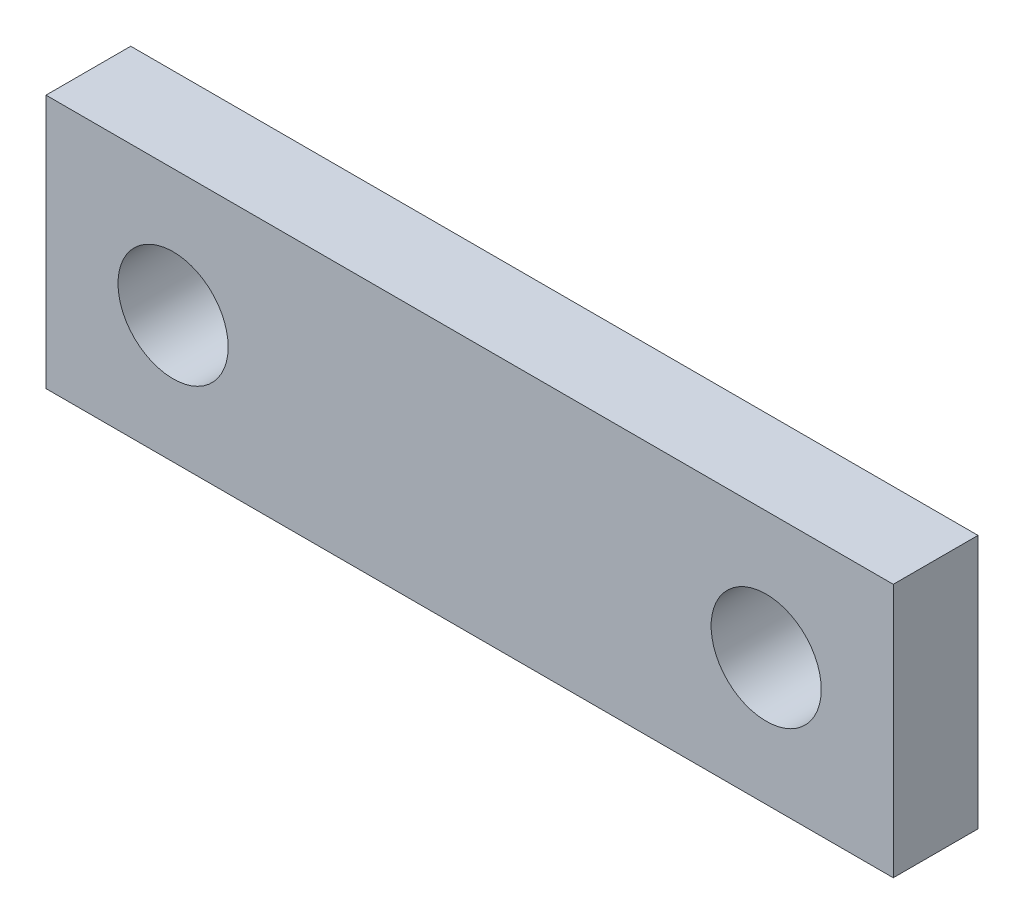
SolidWorks part; units mm, degrees
ref_plane "Plan de face" through (0, 0, 0) normal (0, 0, 1) x (1, 0, 0)
ref_plane "Plan de dessus" through (0, 0, 0) normal (0, 1, 0) x (1, 0, 0)
ref_plane "Plan de droite" through (0, 0, 0) normal (1, 0, 0) x (0, 0, -1)
sketch "Esquisse1" plane through (0, 0, 0) normal (0, 0, 1) x (1, 0, 0)
  line L1 (-50, 15) -> (50, 15)
  line L2 (-50, 15) -> (-50, -15)
  line L3 (-50, -15) -> (50, -15)
  line L4 (50, 15) -> (50, -15)
  point P4 (-50, 0)
  point P6 (0, 15)
  dimension "D1" = 30
  dimension "D2" = 100
extrude "Extrusion1" add sketch "Esquisse1" along normal blind 10
sketch "Esquisse2" plane through (0, 0, 10) normal (0, 0, 1) x (1, 0, 0)
  circle A0 centre (-35, 0) radius 6.5
  circle A1 centre (35, 0) radius 6.5
  dimension "D1" = 13
  dimension "D2" = 70
  dimension "D3" = 35
extrude "Enlèv. mat.-Extru.1" cut sketch "Esquisse2" against normal blind 10
sketch "Esquisse3" plane through (0, 0, 10) normal (0, 0, 1) x (1, 0, 0)
  point P0 (-35, 0)
  point P1 (35, 0)
equation "\"D3@Esquisse2\" = \"D2@Esquisse2\" / 2"
